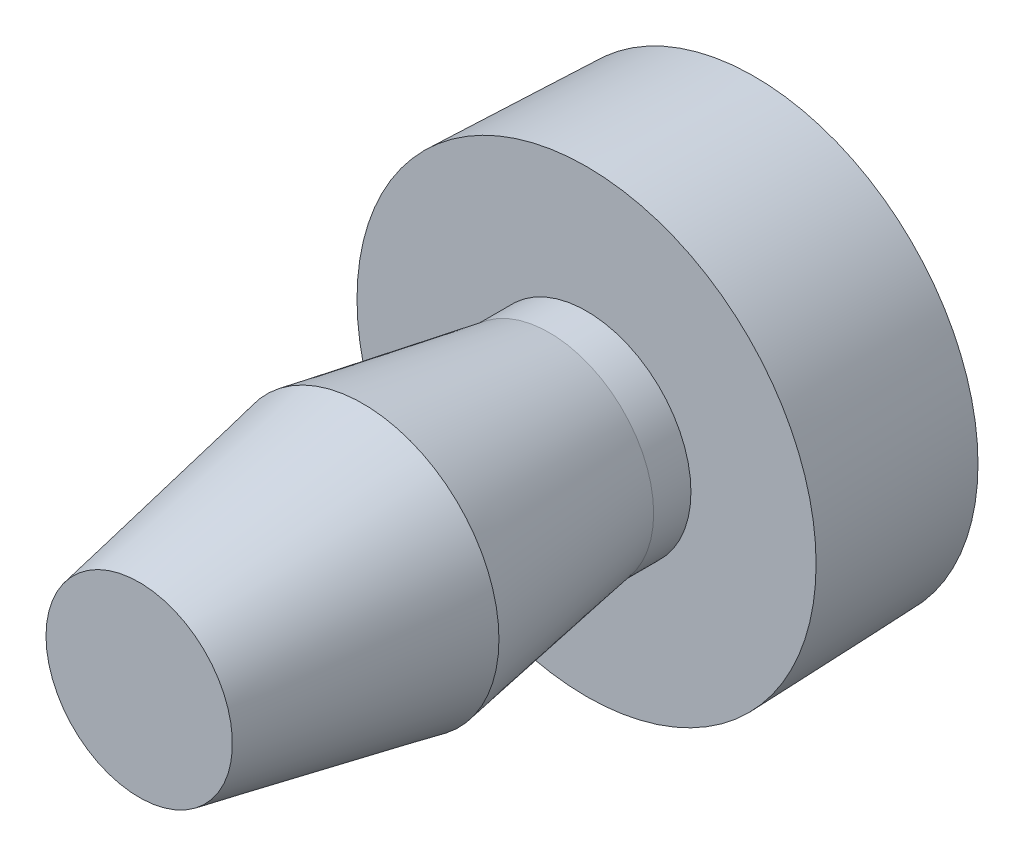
SolidWorks part; units mm, degrees
ref_plane "Plane1" through (0, 0, 0) normal (0, 0, 1) x (1, 0, 0)
ref_plane "Plane2" through (0, 0, 0) normal (0, 1, 0) x (1, 0, 0)
ref_plane "Plane3" through (0, 0, 0) normal (1, 0, 0) x (0, 0, -1)
sketch "Esquisse1" plane through (0, 0, 0) normal (0, 0, 1) x (1, 0, 0)
  circle A0 centre (0, 0) radius 6
  dimension "D1" = 12
extrude "BaseExtrusion" add sketch "Esquisse1" along normal blind 4.5 draft 2
sketch "Esquisse3" plane through (0, 0, 0) normal (1, 0, 0) x (0, 0, -1)
  line L0 (-1.9641, 0) -> (-11.7599, 0) construction
  line L1 (-4.5, 2.8) -> (-5.5, 2.8)
  line L2 (-4.5, 6.1571) -> (-4.5, -6.1571) construction
  line L3 (-5.5, 2.8) -> (-10.5, 3.65)
  line L4 (-10.5, 3.65) -> (-16.5, 2.5)
  line L5 (-16.5, 2.5) -> (-16.5, 0)
  line L6 (-4.5, 0) -> (-16.5, 0)
  line L7 (-4.5, 2.8) -> (-4.5, 0)
  dimension "D1" = 2.8
  dimension "D2" = 3.65
  dimension "D3" = 6
  dimension "D4" = 1
  dimension "D5" = 2.5
  dimension "D6" = 12
revolve "Bossage-Rotation1" add sketch "Esquisse3" angle 360 about L0
